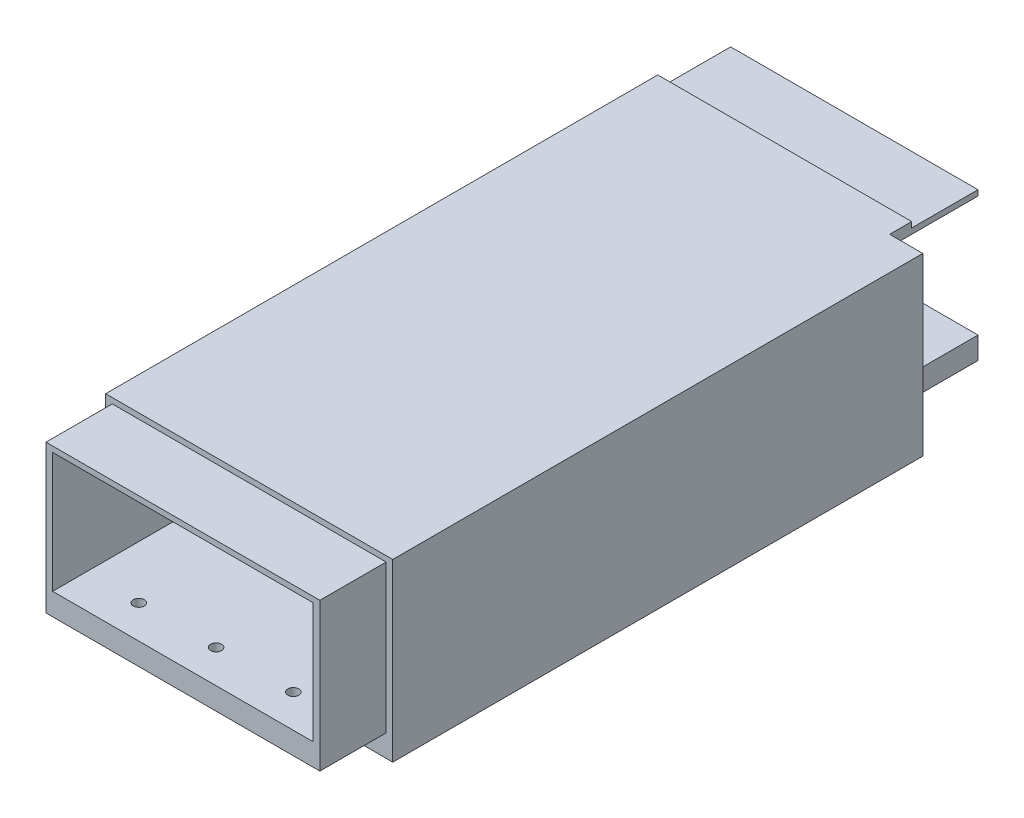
SolidWorks part; units mm, degrees
ref_plane "前视基准面" through (0, 0, 0) normal (0, 0, 1) x (1, 0, 0)
ref_plane "上视基准面" through (0, 0, 0) normal (0, 1, 0) x (1, 0, 0)
ref_plane "右视基准面" through (0, 0, 0) normal (1, 0, 0) x (0, 0, -1)
sketch "草图1" plane through (0, 0, 1400) normal (0, 0, 1) x (1, 0, 0)
  line L1 (-119.3024, 140.0174) -> (5.7729, 140.0174)
  line L2 (-119.3024, 140.0174) -> (-119.3024, 73.0247)
  line L3 (-119.3024, 73.0247) -> (5.7729, 73.0247)
  line L4 (5.7729, 140.0174) -> (5.7729, 73.0247)
  line L5 (-116.3024, 137.5174) -> (1.6976, 137.5174)
  line L6 (-116.3024, 137.5174) -> (-116.3024, 83.0247)
  line L7 (-116.3024, 83.0247) -> (1.6976, 83.0247)
  line L8 (1.6976, 137.5174) -> (1.6976, 83.0247)
extrude "凸台-拉伸1" add sketch "草图1" along normal up to surface (30 mm away)
sketch "草图2" plane through (0, 0, 1430) normal (0, 0, 1) x (1, 0, 0)
  line L1 (-122.3024, 63.0247) -> (7.6976, 63.0247)
  line L2 (-122.3024, 63.0247) -> (-122.3024, 142.5174)
  line L3 (-122.3024, 142.5174) -> (7.6976, 142.5174)
  line L4 (7.6976, 63.0247) -> (7.6976, 142.5174)
extrude "凸台-拉伸2" add sketch "草图2" along normal blind 250
sketch "草图3" plane through (0, 0, 1430) normal (0, 0, -1) x (-1, 0, 0)
  line L1 (-1.6976, 137.5174) -> (116.3024, 137.5174)
  line L2 (-1.6976, 137.5174) -> (-1.6976, 83.0247)
  line L3 (-1.6976, 83.0247) -> (116.3024, 83.0247)
  line L4 (116.3024, 137.5174) -> (116.3024, 83.0247)
extrude "切除-拉伸1" cut sketch "草图3" against normal up to next
sketch "草图4" plane through (0, 0, 1680) normal (0, 0, 1) x (1, 0, 0)
  line L0 (-122.3024, 142.5174) -> (-122.3024, 63.0247) construction
  line L1 (-119.3024, 140.0174) -> (4.6976, 140.0174)
  line L2 (-119.3024, 140.0174) -> (-119.3024, 73.0247)
  line L3 (-119.3024, 73.0247) -> (4.6976, 73.0247)
  line L4 (4.6976, 140.0174) -> (4.6976, 73.0247)
  line L5 (7.6976, 63.0247) -> (7.6976, 142.5174) construction
  line L6 (7.6976, 142.5174) -> (-122.3024, 142.5174) construction
  line L7 (-122.3024, 63.0247) -> (7.6976, 63.0247) construction
  line L9 (-116.3024, 137.5174) -> (1.6976, 137.5174)
  line L10 (-116.3024, 137.5174) -> (-116.3024, 83.0247)
  line L11 (-116.3024, 83.0247) -> (1.6976, 83.0247)
  line L12 (1.6976, 137.5174) -> (1.6976, 83.0247)
  dimension "D1" = 3
  dimension "D2" = 3
  dimension "D3" = 2.5
  dimension "D4" = 10
extrude "凸台-拉伸3" add sketch "草图4" along normal blind 30
sketch "草图5" plane through (0, 73.0247, 0) normal (0, -1, 0) x (1, 0, 0)
  circle A0 centre (-92.3024, 1415) radius 2.5
  circle A1 centre (-57.3024, 1415) radius 2.5
  circle A2 centre (-22.3024, 1415) radius 2.5
extrude "切除-拉伸2" cut sketch "草图5" against normal up to next
sketch "草图6" plane through (0, 73.0247, 0) normal (0, -1, 0) x (1, 0, 0)
  circle A0 centre (-92.3024, 1695) radius 2.5
  circle A1 centre (-57.3024, 1695) radius 2.5
  circle A2 centre (-22.3024, 1695) radius 2.5
extrude "切除-拉伸3" cut sketch "草图6" against normal up to next
sketch "草图7" plane through (7.6976, 0, 0) normal (1, 0, 0) x (0, 0, -1)
  line L0 (-1680, 142.5174) -> (-1430, 142.5174) construction
  line L1 (-1440, 142.5174) -> (-1400, 142.5174)
  line L2 (-1440, 142.5174) -> (-1440, 63.0247)
  line L3 (-1440, 63.0247) -> (-1400, 63.0247)
  line L4 (-1400, 142.5174) -> (-1400, 63.0247)
  line L5 (-1430, 63.0247) -> (-1280, 63.0247) construction
  line L6 (-1400, 73.0247) -> (-1400, 140.0174) construction
  dimension "D1" = 40
  dimension "D2" = 0
extrude "切除-拉伸4" cut sketch "草图7" against normal blind 15
